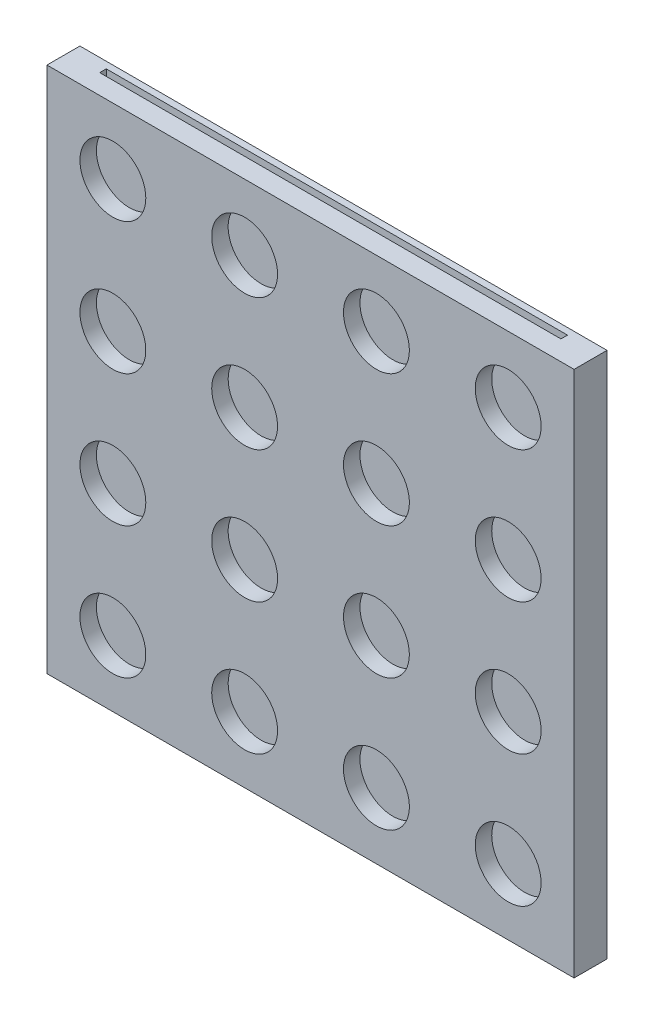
SolidWorks part; units mm, degrees
ref_plane "Front Plane" through (0, 0, 0) normal (0, 0, 1) x (1, 0, 0)
ref_plane "Top Plane" through (0, 0, 0) normal (0, 1, 0) x (1, 0, 0)
ref_plane "Right Plane" through (0, 0, 0) normal (1, 0, 0) x (0, 0, -1)
sketch "Sketch1" plane through (0, 0, 0) normal (0, 0, 1) x (1, 0, 0)
  line L1 (0, 0) -> (101.6, 0)
  line L2 (0, 0) -> (0, 101.6)
  line L3 (0, 101.6) -> (101.6, 101.6)
  line L4 (101.6, 0) -> (101.6, 101.6)
  dimension "D1" = 101.6
  dimension "D2" = 101.6
extrude "Boss-Extrude1" add sketch "Sketch1" along normal blind 6.35
sketch "Sketch3" plane through (0, 0, 6.35) normal (0, 0, 1) x (1, 0, 0)
  line L0 (0, 101.6) -> (0, 0) construction
  line L1 (101.6, 101.6) -> (0, 101.6) construction
  line L2 (0, 0) -> (101.6, 0) construction
  line L3 (25.4, 101.6) -> (25.4, 0)
  line L5 (12.7, 152.4) -> (12.7, 0)
  line L6 (38.1, 101.6) -> (38.1, 0)
  line L7 (50.8, 101.6) -> (50.8, 0)
  line L8 (63.5, 101.6) -> (63.5, 0)
  line L9 (76.2, 101.6) -> (76.2, 0)
  line L10 (88.9, 101.6) -> (88.9, 0)
  line L11 (0, 12.7) -> (101.6, 12.7)
  line L12 (101.6, 0) -> (101.6, 101.6) construction
  line L13 (0, 25.4) -> (101.6, 25.4)
  line L14 (0, 38.1) -> (101.6, 38.1)
  line L15 (0, 50.8) -> (101.6, 50.8)
  line L16 (0, 63.5) -> (101.6, 63.5)
  line L17 (0, 63.6141) -> (101.6, 63.6141)
  line L18 (0, 76.2) -> (101.6, 76.2)
  line L19 (0, 88.9) -> (101.6, 88.9)
  line L20 (0, 101.6) -> (101.6, 101.6)
  line L21 (0, 114.3) -> (101.6, 114.3)
  line L22 (0, 127) -> (101.6, 127)
  line L23 (0, 139.7) -> (101.6, 139.7)
  circle A0 centre (12.7, 139.7) radius 6.35
  circle A2 centre (38.1, 139.7) radius 6.35
  circle A4 centre (63.5, 139.7) radius 6.35
  circle A6 centre (88.9, 139.7) radius 6.35
  circle A7 centre (88.9, 114.3) radius 6.35
  circle A8 centre (63.5, 114.3) radius 6.35
  circle A9 centre (38.1, 114.3) radius 6.35
  circle A10 centre (12.7, 114.3) radius 6.35
  circle A11 centre (88.9, 88.9) radius 6.35
  circle A12 centre (63.5, 88.9) radius 6.35
  circle A13 centre (38.1, 88.9) radius 6.35
  circle A14 centre (12.7, 88.9) radius 6.35
  circle A15 centre (88.9, 63.5) radius 6.35
  circle A16 centre (63.5, 63.5) radius 6.35
  circle A17 centre (38.1, 63.5) radius 6.35
  circle A18 centre (12.7, 63.5) radius 6.35
  circle A19 centre (88.9, 38.1) radius 6.35
  circle A20 centre (63.5, 38.1) radius 6.35
  circle A21 centre (38.1, 38.1) radius 6.35
  circle A22 centre (12.7, 38.1) radius 6.35
  circle A23 centre (88.9, 12.7) radius 6.35
  circle A24 centre (63.5, 12.7) radius 6.35
  circle A25 centre (38.1, 12.7) radius 6.35
  circle A26 centre (12.7, 12.7) radius 6.35
  dimension "D1" = 12.7
  dimension "D2" = 12.7
  dimension "D3" = 12.7
  dimension "D4" = 12.7
  dimension "D5" = 12.7
  dimension "D6" = 12.7
  dimension "D7" = 12.7
  dimension "D8" = 12.7
  dimension "D9" = 12.7
  dimension "D10" = 12.7
  dimension "D11" = 12.7
  dimension "D12" = 12.7
  dimension "D13" = 12.7
  dimension "D14" = 12.7
  dimension "D15" = 12.7
  dimension "D16" = 12.7
  dimension "D17" = 12.7
  dimension "D18" = 12.7
extrude "Cut-Extrude2" cut sketch "Sketch3" against normal blind 3.175 contours A0 | A2 | A4 | A6 | A7 | A8 | A9 | A10 | A14 | A13 | A12 | A11 | A18 | A17 | A16 | A15 | A22 | A21 | A20 | A19 | A26 | A25 | A24 | A23
sketch "Sketch4" plane through (0, 0, 0) normal (0, 0, -1) x (-1, 0, 0)
  line L0 (-95.25, 6.35) -> (-6.35, 6.35)
  line L1 (-6.35, 6.35) -> (-6.35, 95.25)
  line L2 (-6.35, 95.25) -> (-95.25, 95.25)
  line L3 (-95.25, 95.25) -> (-95.25, 6.35)
  line L4 (-101.6, 0) -> (-101.6, 101.6) construction
  line L5 (0, 101.6) -> (0, 0) construction
  line L6 (0, 0) -> (-101.6, 0) construction
  line L7 (-101.6, 101.6) -> (0, 101.6) construction
  dimension "D1" = 6.35
  dimension "D2" = 6.35
  dimension "D3" = 6.35
  dimension "D4" = 6.35
extrude "Cut-Extrude3" cut sketch "Sketch4" against normal blind 2.54
sketch "Sketch5" plane through (0, 101.6, 0) normal (0, 1, 0) x (1, 0, 0)
  line L0 (6.35, -1.27) -> (6.35, -2.54)
  line L1 (6.35, -2.54) -> (95.25, -2.54)
  line L2 (95.25, -2.54) -> (95.25, -1.27)
  line L3 (95.25, -1.27) -> (6.35, -1.27)
  line L4 (0, -6.35) -> (0, 0) construction
  line L6 (101.6, -6.35) -> (101.6, 0) construction
  line L7 (101.6, 0) -> (0, 0) construction
  dimension "D1" = 6.35
  dimension "D2" = 6.35
  dimension "D3" = 1.27
  dimension "D4" = 1.27
extrude "Cut-Extrude4" cut sketch "Sketch5" against normal up to next
